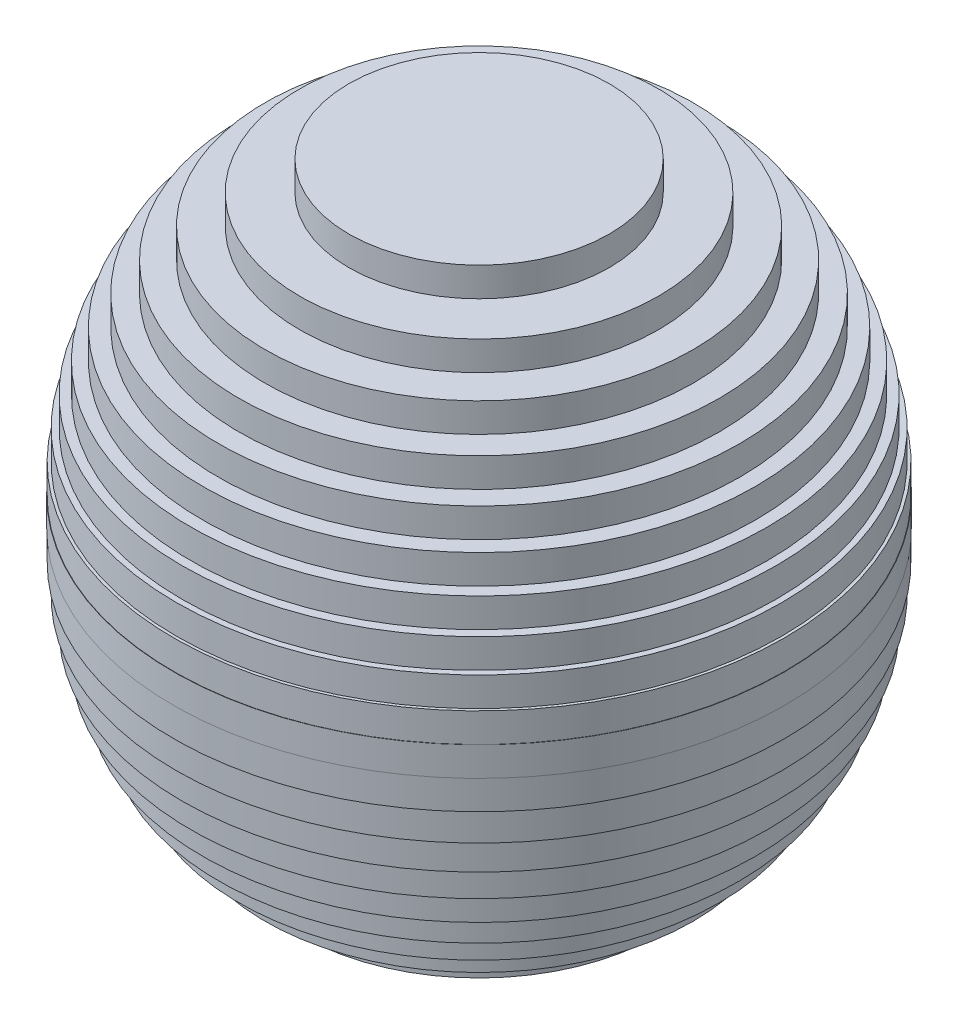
SolidWorks part; units mm, degrees
ref_plane "Front Plane" through (0, 0, 0) normal (0, 0, 1) x (1, 0, 0)
ref_plane "Top Plane" through (0, 0, 0) normal (0, 1, 0) x (1, 0, 0)
ref_plane "Right Plane" through (0, 0, 0) normal (1, 0, 0) x (0, 0, -1)
sketch "Sketch1" plane through (0, 0, 0) normal (0, 0, 1) x (1, 0, 0)
  line L0 (0, -52.5) -> (0, 52.5) construction
  line L1 (0, -52.5) -> (52.5, -52.5) construction
  line L2 (0, -47.5) -> (52.5, -47.5) construction
  line L3 (0, -42.5) -> (52.5, -42.5) construction
  line L4 (0, -37.5) -> (52.5, -37.5) construction
  line L5 (0, -32.5) -> (52.5, -32.5) construction
  line L6 (0, -27.5) -> (52.5, -27.5) construction
  line L7 (0, -22.5) -> (52.5, -22.5) construction
  line L35 (0, -17.5) -> (52.5, -17.5) construction
  line L36 (0, -12.5) -> (52.5, -12.5) construction
  line L37 (0, -7.5) -> (52.5, -7.5) construction
  line L38 (0, -2.5) -> (52.5, -2.5) construction
  line L39 (0, 2.5) -> (52.5, 2.5) construction
  line L40 (0, 7.5) -> (52.5, 7.5) construction
  line L41 (0, 12.5) -> (52.5, 12.5) construction
  line L42 (0, 17.5) -> (52.5, 17.5) construction
  line L43 (0, 22.5) -> (52.5, 22.5) construction
  line L44 (0, 27.5) -> (52.5, 27.5) construction
  line L45 (0, 32.5) -> (52.5, 32.5) construction
  line L46 (0, 37.5) -> (52.5, 37.5) construction
  line L47 (0, 42.5) -> (52.5, 42.5) construction
  line L48 (0, 47.5) -> (52.5, 47.5) construction
  arc A0 (0, 52.5) -> (0, -52.5) centre (0, 0) cw construction
  point P4 (0, 0)
  point P7 (52.5, 0)
  point P8 (0, 52.5)
sketch "Sketch5" plane through (0, 0, 0) normal (0, 0, 1) x (1, 0, 0)
  line L0 (52.5, 2.5) -> (52.5, -2.5)
  line L1 (52.5, -2.5) -> (52.4404, -2.5)
  line L2 (0, -2.5) -> (52.5, -2.5) construction
  line L3 (52.4404, -2.5) -> (52.4404, -7.5)
  line L4 (0, -7.5) -> (52.5, -7.5) construction
  line L5 (52.4404, -7.5) -> (51.9615, -7.5)
  line L6 (51.9615, -7.5) -> (51.9615, -12.5)
  line L7 (0, -12.5) -> (52.5, -12.5) construction
  line L8 (51.9615, -12.5) -> (50.9902, -12.5)
  line L9 (50.9902, -12.5) -> (50.9902, -17.5)
  line L10 (0, -17.5) -> (52.5, -17.5) construction
  line L11 (50.9902, -17.5) -> (49.4975, -17.5)
  line L12 (49.4975, -17.5) -> (49.4975, -22.5)
  line L13 (0, -22.5) -> (52.5, -22.5) construction
  line L14 (49.4975, -22.5) -> (47.4342, -22.5)
  line L15 (47.4342, -22.5) -> (47.4342, -27.5)
  line L16 (0, -27.5) -> (52.5, -27.5) construction
  line L17 (47.4342, -27.5) -> (44.7214, -27.5)
  line L18 (44.7214, -27.5) -> (44.7214, -32.5)
  line L19 (0, -32.5) -> (52.5, -32.5) construction
  line L20 (44.7214, -32.5) -> (41.2311, -32.5)
  line L21 (41.2311, -32.5) -> (41.2311, -37.5)
  line L22 (0, -37.5) -> (52.5, -37.5) construction
  line L23 (41.2311, -37.5) -> (36.7423, -37.5)
  line L24 (36.7423, -37.5) -> (36.7423, -42.5)
  line L25 (0, -42.5) -> (52.5, -42.5) construction
  line L26 (36.7423, -42.5) -> (30.8221, -42.5)
  line L27 (30.8221, -42.5) -> (30.8221, -47.5)
  line L28 (0, -47.5) -> (52.5, -47.5) construction
  line L29 (30.8221, -47.5) -> (22.3607, -47.5)
  line L30 (22.3607, -47.5) -> (22.3607, -52.5)
  line L31 (0, -52.5) -> (52.5, -52.5) construction
  line L32 (22.3607, -52.5) -> (0, -52.5)
  line L33 (0, -52.5) -> (0, 52.5)
  line L34 (0, 52.5) -> (22.3607, 52.5)
  line L35 (22.3607, 52.5) -> (22.3607, 47.5)
  line L36 (0, 47.5) -> (52.5, 47.5) construction
  line L37 (22.3607, 47.5) -> (30.8221, 47.5)
  line L38 (30.8221, 47.5) -> (30.8221, 42.5)
  line L39 (0, 42.5) -> (52.5, 42.5) construction
  line L40 (30.8221, 42.5) -> (36.7423, 42.5)
  line L41 (36.7423, 42.5) -> (36.7423, 37.5)
  line L42 (0, 37.5) -> (52.5, 37.5) construction
  line L43 (36.7423, 37.5) -> (41.2311, 37.5)
  line L44 (41.2311, 37.5) -> (41.2311, 32.5)
  line L45 (0, 32.5) -> (52.5, 32.5) construction
  line L46 (41.2311, 32.5) -> (44.7214, 32.5)
  line L47 (44.7214, 32.5) -> (44.7214, 27.5)
  line L48 (0, 27.5) -> (52.5, 27.5) construction
  line L49 (44.7214, 27.5) -> (47.4342, 27.5)
  line L50 (47.4342, 27.5) -> (47.4342, 22.5)
  line L51 (0, 22.5) -> (52.5, 22.5) construction
  line L52 (47.4342, 22.5) -> (49.4975, 22.5)
  line L53 (49.4975, 22.5) -> (49.4975, 17.5)
  line L54 (0, 17.5) -> (52.5, 17.5) construction
  line L55 (49.4975, 17.5) -> (50.9902, 17.5)
  line L56 (50.9902, 17.5) -> (50.9902, 12.5)
  line L57 (0, 12.5) -> (52.5, 12.5) construction
  line L58 (50.9902, 12.5) -> (51.9615, 12.5)
  line L59 (51.9615, 12.5) -> (51.9615, 7.5)
  line L60 (0, 7.5) -> (52.5, 7.5) construction
  line L61 (51.9615, 7.5) -> (52.4404, 7.5)
  line L62 (52.4404, 7.5) -> (52.4404, 2.5)
  line L63 (0, 2.5) -> (52.5, 2.5) construction
  line L64 (52.4404, 2.5) -> (52.5, 2.5)
  arc A0 (0, -52.5) -> (0, 52.5) centre (0, 0) ccw construction
revolve "Revolve5" add sketch "Sketch5" angle 360 about L33
equation "\"Ball Diameter\"= \"Layers\" * \"Layer Height\""
equation "\"Layers\"=21"
equation "\"D1@Sketch1\"=\"Ball Diameter\""
equation "\"Layer Height\"= 5mm"
equation "\"D3@Sketch1\"=\"Layer Height\""
equation "\"D2@Sketch1\"=\"Layers\""
